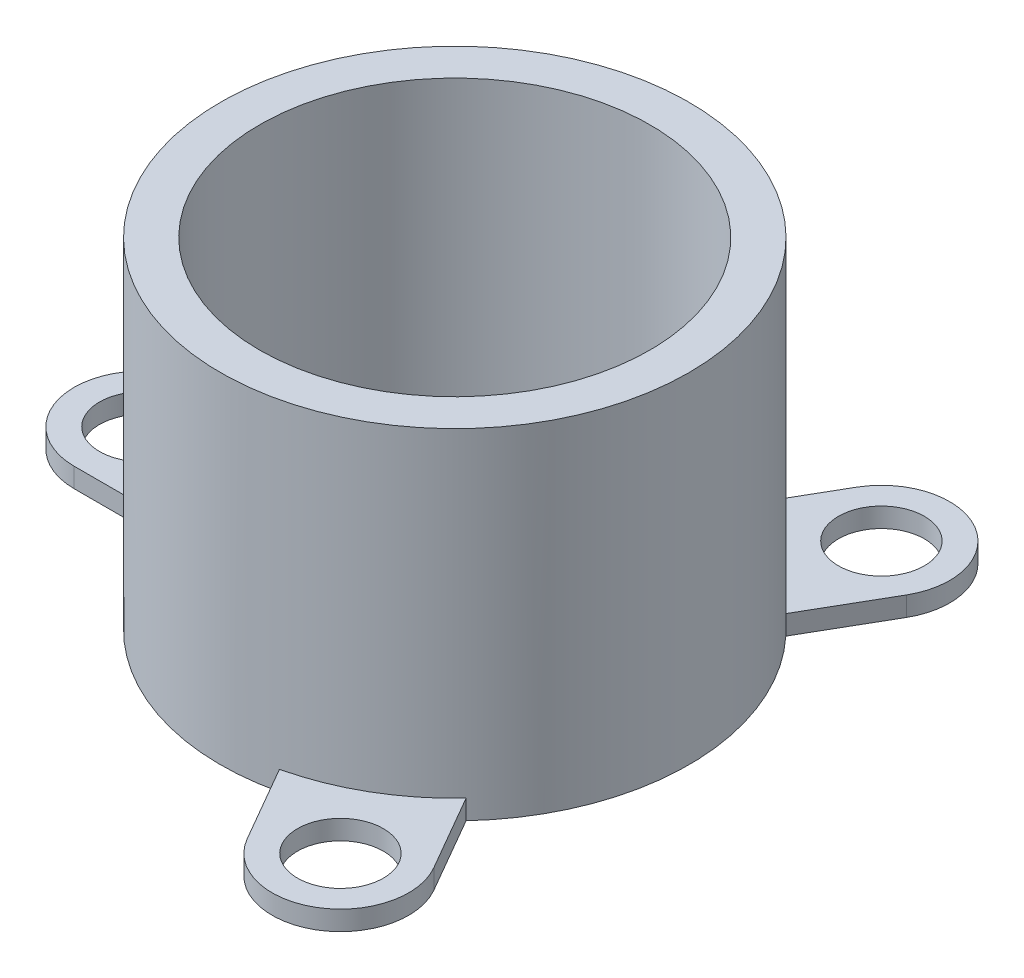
SolidWorks part; units mm, degrees
ref_plane "Front Plane" through (0, 0, 0) normal (0, 0, 1) x (1, 0, 0)
ref_plane "Top Plane" through (0, 0, 0) normal (0, 1, 0) x (1, 0, 0)
ref_plane "Right Plane" through (0, 0, 0) normal (1, 0, 0) x (0, 0, -1)
sketch "Sketch1" plane through (0, 0, 0) normal (0, 1, 0) x (1, 0, 0)
  circle A0 centre (0, 0) radius 50
extrude "Extrude-Thin1" add sketch "Sketch1" along normal blind 87 thin
sketch "Sketch2" plane through (0, 0, 0) normal (0, -1, 0) x (1, 0, 0)
  line L0 (-80, 17.5) -> (-57.3912, 17.5)
  line L1 (-80, -17.5) -> (-57.3912, -17.5)
  circle A0 centre (-80, 0) radius 11
  arc A1 (-80, 17.5) -> (-80, -17.5) centre (-80, 0) ccw
  circle A2 centre (0, 0) radius 60 construction
  dimension "D1" = 80
  dimension "D2" = 35
  dimension "D3" = 22
extrude "Boss-Extrude1" add sketch "Sketch2" against normal blind 5 contours L0 A1 L1 A0 M3
pattern_circular "CirPattern1" count 3 over 360 about axis through (0, 0, 0) along (0, 1, 0) of "Boss-Extrude1"
sketch "Sketch4" plane through (0, 87, 0) normal (0, 1, 0) x (1, 0, 0)
  point P0 (0, 0)
